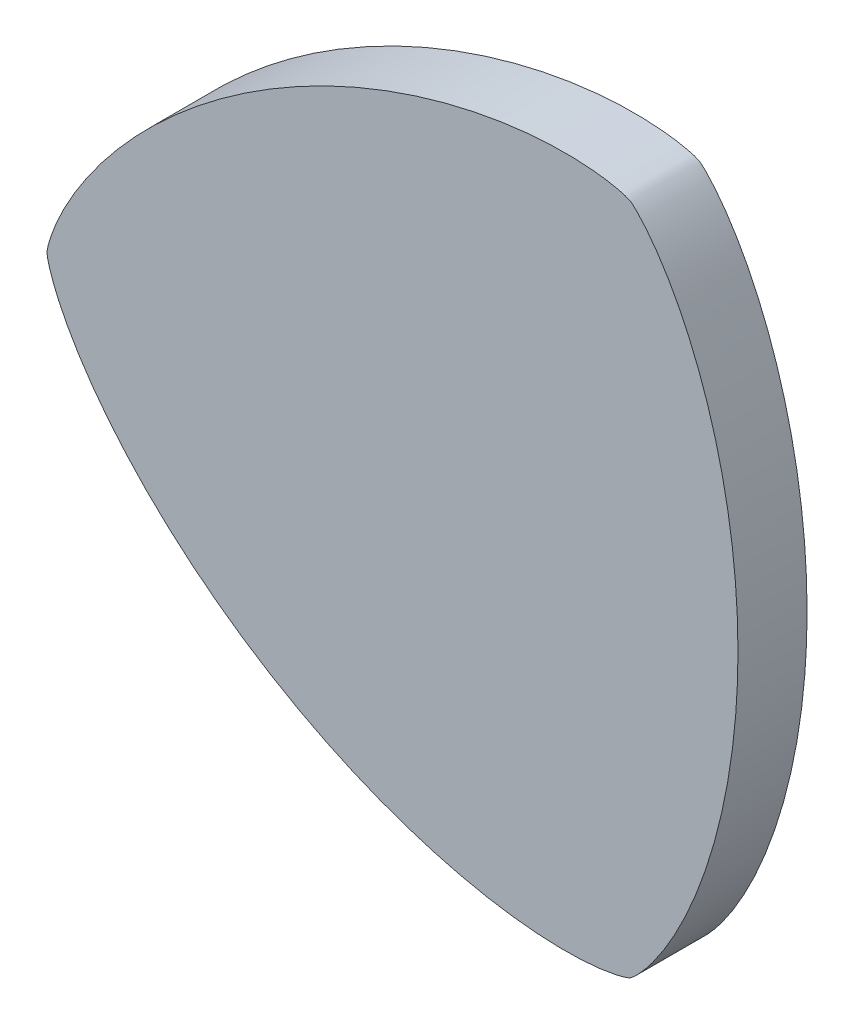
SolidWorks part; units mm, degrees
ref_plane "Ebene vorne" through (0, 0, 0) normal (0, 0, 1) x (1, 0, 0)
ref_plane "Ebene oben" through (0, 0, 0) normal (0, 1, 0) x (1, 0, 0)
ref_plane "Ebene rechts" through (0, 0, 0) normal (1, 0, 0) x (0, 0, -1)
sketch "Skizze1" plane through (0, 0, 0) normal (0, 0, 1) x (1, 0, 0)
  spline S0 degree 3 poles (43.4003, -10.2183) (43.9292, 0) (43.4003, 10.2183) (41.8948, 19.845) (39.6419, 28.3669) (36.9761, 35.416) (34.2738, 40.8095) (31.8841, 44.5677) (30.0557, 46.8804) (28.8976, 48.0878) (28.3313, 48.5653) (28.1266, 48.7167) (27.8931, 48.8183) (27.1964, 49.07) (25.5718, 49.4692) (22.6547, 49.8963) (18.2052, 50.0867) (12.1831, 49.7303) (4.7455, 48.5143) (-3.7611, 46.2044) (-12.8508, 42.6949) (-21.9646, 38.0438) (-30.5495, 32.4766) (-38.1337, 26.3594) (-44.3874, 20.1475) (-49.1592, 14.3143) (-52.479, 9.2772) (-54.5388, 5.3286) (-55.6275, 2.5888) (-56.0941, 0.9822) (-56.2244, 0.253) (-56.2532, 0) (-56.2244, -0.253) (-56.0941, -0.9822) (-55.6275, -2.5888) (-54.5388, -5.3286) (-52.479, -9.2772) (-49.1592, -14.3143) (-44.3874, -20.1475) (-38.1337, -26.3594) (-30.5495, -32.4766) (-21.9646, -38.0438) (-12.8508, -42.6949) (-3.7611, -46.2044) (4.7455, -48.5143) (12.1831, -49.7303) (18.2052, -50.0867) (22.6547, -49.8963) (25.5718, -49.4692) (27.1964, -49.07) (27.8931, -48.8183) (28.1266, -48.7167) (28.3313, -48.5653) (28.8976, -48.0878) (30.0557, -46.8804) (31.8841, -44.5677) (34.2738, -40.8095) (36.9761, -35.416) (39.6419, -28.3669) (41.8948, -19.845) (43.4003, -10.2183) (43.9292, 0) (43.4003, 10.2183) knots -0.092919 -0.064516 -0.03306 0 0.03306 0.064516 0.092919 0.117122 0.136385 0.150455 0.159586 0.164516 0.166394 0.166667 0.16694 0.168817 0.173747 0.182878 0.196949 0.216212 0.240414 0.268817 0.300273 0.333333 0.366394 0.397849 0.426253 0.450455 0.469718 0.483788 0.492919 0.497849 0.499727 0.5 0.500273 0.502151 0.507081 0.516212 0.530282 0.549545 0.573747 0.602151 0.633606 0.666667 0.699727 0.731183 0.759586 0.783788 0.803051 0.817122 0.826253 0.831183 0.83306 0.833333 0.833606 0.835484 0.840414 0.849545 0.863615 0.882878 0.907081 0.935484 0.96694 1 1.03306 1.064516 1.092919 only from (43.75, 0) to (43.75, 0)
extrude "Linear austragen1" add sketch "Skizze1" along normal blind 10
